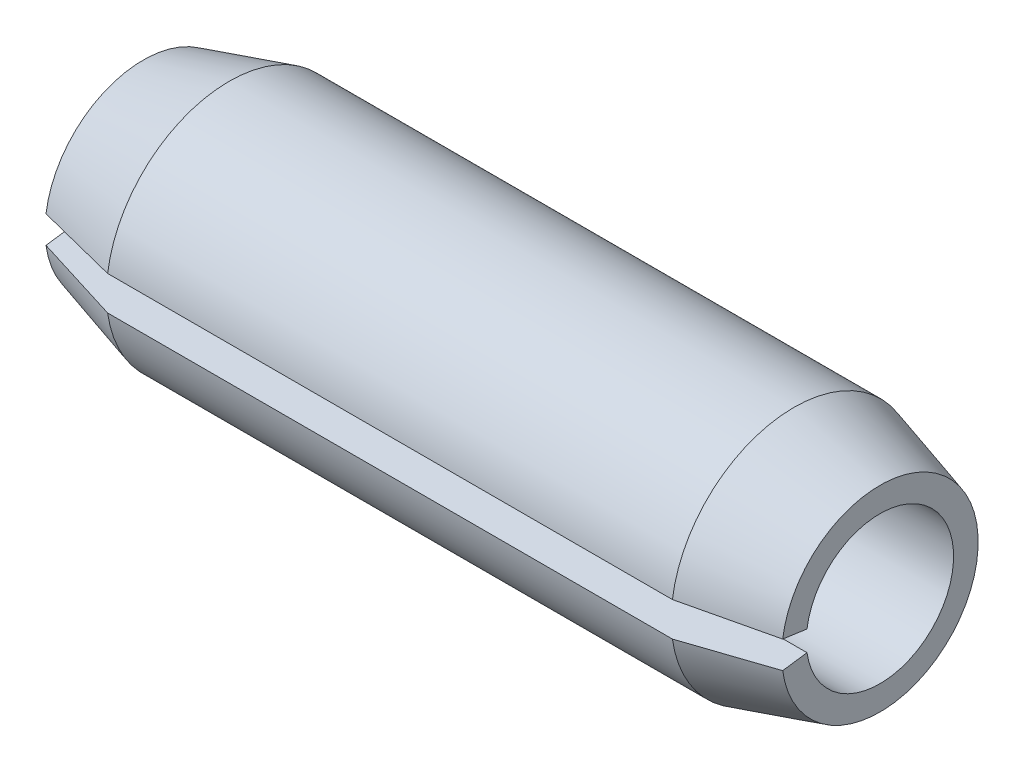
SolidWorks part; units mm, degrees
ref_plane "Front" through (0, 0, 0) normal (0, 0, 1) x (1, 0, 0)
ref_plane "Top" through (0, 0, 0) normal (0, 1, 0) x (1, 0, 0)
ref_plane "Right" through (0, 0, 0) normal (1, 0, 0) x (0, 0, -1)
sketch "Sketch1" plane through (0, 0, 0) normal (1, 0, 0) x (0, 0, -1)
  circle A0 centre (0, 0) radius 0.3 construction
  circle A1 centre (0, 0) radius 0.5
  circle A2 centre (0, 0) radius 0.4
  dimension "d" = 1
  dimension "s1" = 0.2
  dimension "s2" = 0.1
extrude "Base-Extrude" add sketch "Sketch1" along normal blind 3
sketch "Sketch2" plane through (0, 0, 0) normal (1, 0, 0) x (0, 0, -1)
  circle A0 centre (0, 0) radius 0.4 construction
  circle A1 centre (0, 0) radius 0.4
  circle A2 centre (0, 0) radius 0.3
  circle A3 centre (0, 0) radius 0.3 construction
extrude "Extrude2" add sketch "Sketch2" along normal up to surface (3 mm away)
sketch "Sketch3" plane through (0, 0, 0) normal (0, 0, 1) x (1, 0, 0)
  line L0 (3, 0.5) -> (3, 0.4)
  line L2 (3, 0.5) -> (2.65, 0.5)
  line L4 (2.65, 0.5) -> (3, 0.4)
  line L5 (1.5, 0) -> (3.6295, 0) construction
  line L7 (1.5, 0) -> (1.5, 0.7569) construction
  line L8 (0.35, 0.5) -> (0, 0.4)
  line L9 (0, 0.5) -> (0.35, 0.5)
  line L10 (0, 0.5) -> (0, 0.4)
  line L11 (0, -0.4) -> (0, 0.4) construction
  dimension "a" = 0.35
revolve "Cut-Revolve1" cut sketch "Sketch3" angle 360 about L5
sketch "Sketch4" plane through (0, 0, 0) normal (1, 0, 0) x (0, 0, -1)
  line L0 (0, 0) -> (-0.5568, 0) construction
  line L1 (0, 0) -> (-0.6, 0.0843)
  line L2 (-0.6, 0.0843) -> (-0.6, -0.0843)
  line L3 (0, 0) -> (-0.6, -0.0843)
  circle A1 centre (0, 0) radius 0.5 construction
  point P2 (-0.5, 0)
  point P8 (-0.6, 0)
  dimension "D1" = 8
  dimension "D2" = 0.1
extrude "Gap" cut sketch "Sketch4" along normal through all
equation "\"s2@Sketch1\" =  \"s1@Sketch1\" / 2"
